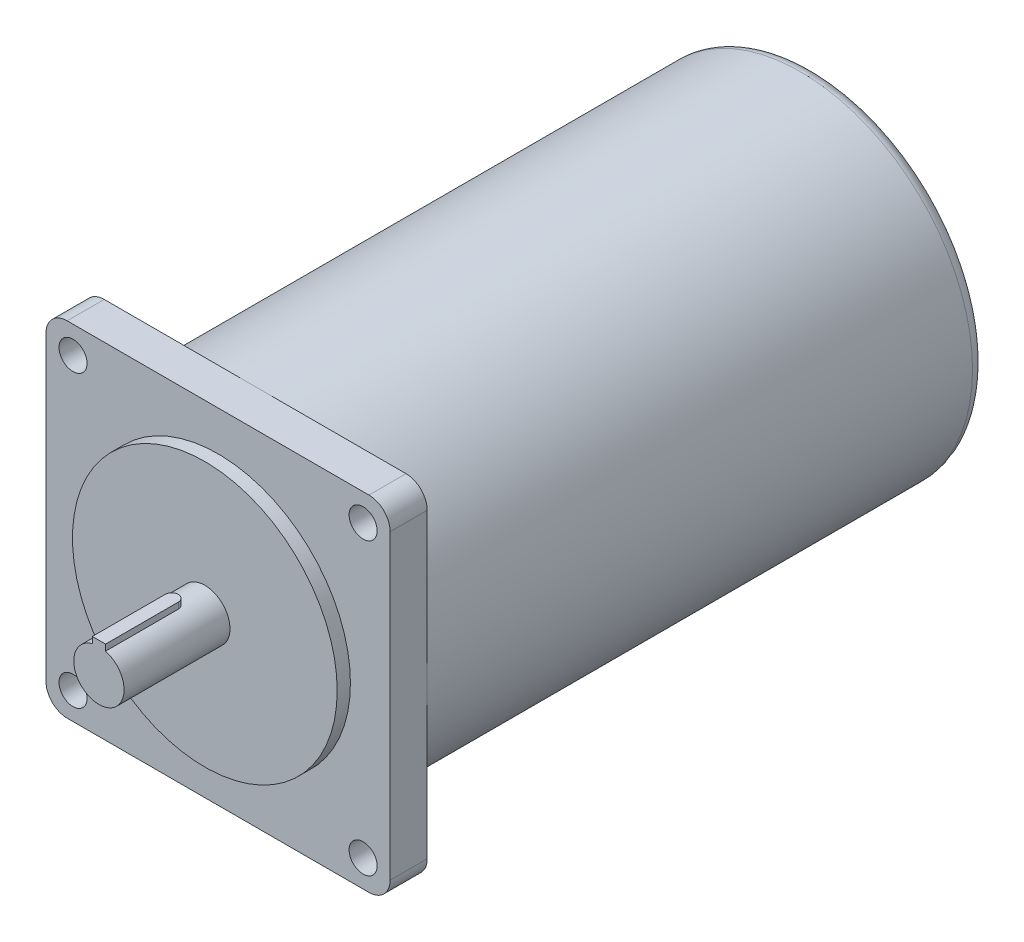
SolidWorks part; units mm, degrees
ref_plane "前视基准面" through (0, 0, 0) normal (0, 0, 1) x (1, 0, 0)
ref_plane "上视基准面" through (0, 0, 0) normal (0, 1, 0) x (1, 0, 0)
ref_plane "右视基准面" through (0, 0, 0) normal (1, 0, 0) x (0, 0, -1)
sketch "草图1" plane through (0, 0, 0) normal (0, 0, 1) x (1, 0, 0)
  circle A0 centre (0, 0) radius 50
extrude "凸台-拉伸1" add sketch "草图1" against normal blind 5
sketch "草图2" plane through (0, 0, 0) normal (0, 0, 1) x (1, 0, 0)
  circle A0 centre (0, 0) radius 9.5
extrude "凸台-拉伸2" add sketch "草图2" along normal blind 40
sketch "草图3" plane through (0, 0, 0) normal (0, 1, 0) x (1, 0, 0)
  line L1 (-9.5, -40) -> (9.5, -40) construction
  line L2 (-2.5, -12.5) -> (-2.5, -40)
  line L3 (-2.5, -40) -> (2.5, -40)
  line L4 (2.5, -40) -> (2.5, -12.5)
  arc A0 (2.5, -12.5) -> (-2.5, -12.5) centre (0, -12.5) ccw
extrude "凸台-拉伸3" add sketch "草图3" along normal blind 11.5
sketch "草图4" plane through (0, 0, -5) normal (0, 0, -1) x (-1, 0, 0)
  line L1 (0, 65) -> (57, 65)
  line L2 (65, 57) -> (65, -57)
  line L3 (57, -65) -> (-57, -65)
  line L4 (-65, -57) -> (-65, 57)
  line L5 (-57, 65) -> (0, 65)
  arc A0 (-57, -65) -> (-65, -57) centre (-57, -57) cw
  arc A1 (65, -57) -> (57, -65) centre (57, -57) cw
  arc A2 (57, 65) -> (65, 57) centre (57, 57) cw
  arc A3 (-65, 57) -> (-57, 65) centre (-57, 57) cw
  circle A4 centre (-54.8, 54.8) radius 5.3
  circle A5 centre (54.8, 54.8) radius 5.3
  circle A6 centre (54.8, -54.8) radius 5.3
  circle A7 centre (-54.8, -54.8) radius 5.3
  dimension "D1" = 8
extrude "凸台-拉伸4" add sketch "草图4" along normal blind 14
sketch "草图6" plane through (0, 0, -19) normal (0, 0, -1) x (-1, 0, 0)
  circle A0 centre (0, 0) radius 65
extrude "凸台-拉伸5" add sketch "草图6" along normal blind 211
fillet "圆角1" radius 5 1 edges at (-65, 0, -230)
